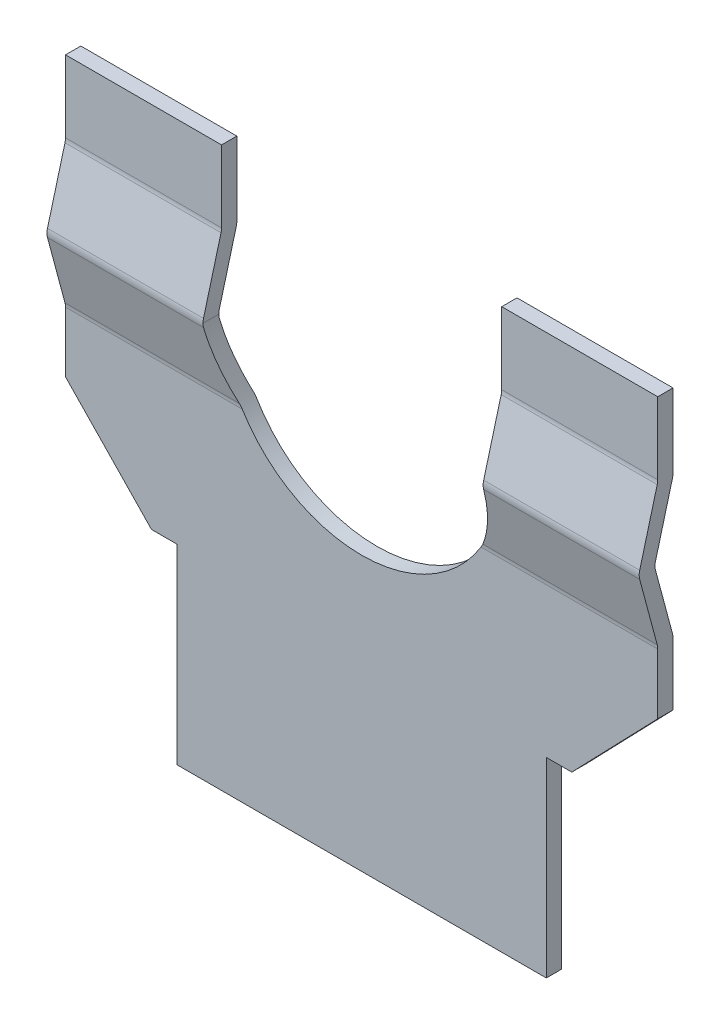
SolidWorks part; units mm, degrees
ref_plane "Plan de face" through (0, 0, 0) normal (0, 0, 1) x (1, 0, 0)
ref_plane "Plan de dessus" through (0, 0, 0) normal (0, 1, 0) x (1, 0, 0)
ref_plane "Plan de droite" through (0, 0, 0) normal (1, 0, 0) x (0, 0, -1)
sketch "Esquisse1" plane through (0, 0, 0) normal (0, 0, 1) x (1, 0, 0)
  line L0 (0, 0) -> (0, 521.276) construction
  line L1 (-145, 0) -> (145, 0)
  line L2 (145, 0) -> (145, 150)
  line L3 (145, 150) -> (165, 150)
  line L4 (165, 150) -> (232.5, 220)
  line L5 (232.5, 220) -> (232.5, 439)
  line L6 (232.5, 439) -> (110, 439)
  line L7 (110, 439) -> (110, 325)
  line L8 (-110, 439) -> (-110, 325)
  line L9 (-232.5, 439) -> (-110, 439)
  line L10 (-232.5, 220) -> (-232.5, 439)
  line L11 (-165, 150) -> (-232.5, 220)
  line L12 (-145, 150) -> (-165, 150)
  line L13 (-145, 0) -> (-145, 150)
  arc A0 (-110, 325) -> (110, 325) centre (0, 325) ccw
  dimension "D8" = 325
  dimension "D1" = 439
  dimension "D2" = 145
  dimension "D3" = 150
  dimension "D4" = 232.5
  dimension "D5" = 220
  dimension "D6" = 165
  dimension "D7" = 110
extrude "Extrusion1" add sketch "Esquisse1" along normal blind 27
sketch "Esquisse2" plane through (0, 0, 0) normal (1, 0, 0) x (0, 0, -1)
  line L0 (-12, -31.6798) -> (-12, 269.0192)
  line L1 (-12, 269.0192) -> (-27, 325)
  line L2 (-27, 325) -> (-12, 380.9808)
  line L3 (-12, 380.9808) -> (-12, 468.8564)
  line L4 (-12, 468.8564) -> (-89.7628, 468.8564)
  line L5 (-89.7628, 468.8564) -> (-89.7628, -31.6798)
  line L6 (-89.7628, -31.6798) -> (-12, -31.6798)
  line L7 (-14.5767, 325) -> (9.4463, 414.655)
  line L8 (-14.5767, 325) -> (9.4463, 235.345)
  line L9 (9.4463, 235.345) -> (9.4463, 414.655)
  line L10 (0, 439) -> (0, 220) construction
  line L11 (0, 150) -> (0, 0) construction
  line L12 (-27, 0) -> (0, 0) construction
  dimension "D1" = 15
  dimension "D2" = 12
  dimension "D3" = 15
  dimension "D4" = 12
  dimension "D5" = 12
  dimension "D6" = 165
  dimension "D7" = 325
extrude "Enlèv. mat.-Extru.1" cut sketch "Esquisse2" against normal through all and the other way through all
fillet "Congé1" radius 12 12 edges at (171.25, 380.9808, 12) (171.25, 325, 27) (163.5949, 269.0192, 12) (-163.5949, 269.0192, 12) (-171.25, 325, 27) (-171.25, 380.9808, 12) (-164.0531, 270.5991, 0) (-171.25, 325, 14.5767) (-171.25, 379.4009, 0) (164.0531, 270.5991, 0) (171.25, 379.4009, 0) (171.25, 325, 14.5767)
